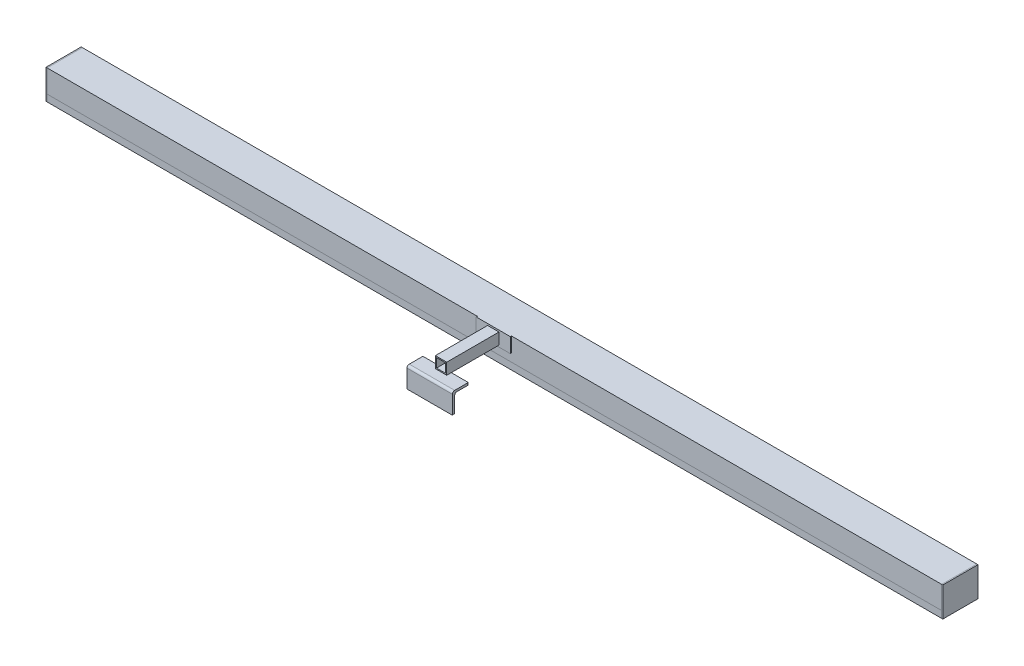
SolidWorks part; units mm, degrees
ref_plane "Alzado" through (0, 0, 0) normal (0, 0, 1) x (1, 0, 0)
ref_plane "Planta" through (0, 0, 0) normal (0, 1, 0) x (1, 0, 0)
ref_plane "Vista lateral" through (0, 0, 0) normal (1, 0, 0) x (0, 0, -1)
sketch "Croquis1" plane through (0, 0, 0) normal (0, 0, 1) x (1, 0, 0)
  line L0 (0, -9) -> (0, 9) construction
  line L1 (-20, 0) -> (20, 0) construction
  line L3 (-20, -9) -> (20, -9)
  line L4 (-20, -9) -> (-20, 9)
  line L5 (-20, 9) -> (20, 9)
  line L6 (20, -9) -> (20, 9)
  point P4 (0, 0)
  point P8 (0, 0)
  point P12 (0, 0)
  point P13 (0, 0)
  dimension "D1" = 18
  dimension "D2" = 40
extrude "Saliente-Extruir1" add sketch "Croquis1" along normal blind 2
sketch "Croquis2" plane through (0, 9, 0) normal (0, 1, 0) x (1, 0, 0)
  line L0 (0, -2) -> (0, 12) construction
  line L1 (20, -2) -> (-20, -2) construction
  line L2 (0, 12) -> (-20, 12)
  line L3 (-20, 12) -> (-20, -2)
  line L4 (-20, -2) -> (20, -2)
  line L5 (20, -2) -> (20, 12)
  line L6 (20, 12) -> (0, 12)
  dimension "D1" = 14
extrude "Saliente-Extruir2" add sketch "Croquis2" against normal blind 2
fillet "Redondeo1" radius 2 1 edges at (0, 7, 0)
fillet "Redondeo2" radius 2 1 edges at (0, 9, 2)
fillet "Redondeo3" radius 0.5 1 edges at (20, -9, 1)
fillet "Redondeo4" radius 0.5 1 edges at (-20, -9, 1)
fillet "Redondeo5" radius 0.5 1 edges at (-20, 8, -12)
fillet "Redondeo6" radius 0.5 1 edges at (20, 8, -12)
ref_plane "Plano1" through (0, 0, -8) normal (0, 0, 1) x (1, 0, 0)
sketch "Croquis5" plane through (0, 0, -8) normal (0, 0, 1) x (1, 0, 0)
  line L0 (0, 9) -> (0, 13.0338) construction
  line L1 (-20, 9) -> (20, 9) construction
  line L2 (-5, 9) -> (5, 9)
  line L3 (-4, 10) -> (-4, 18)
  line L4 (-5, 9) -> (5, 9)
  line L5 (-5, 9) -> (-5, 19)
  line L6 (-5, 19) -> (5, 19)
  line L7 (5, 9) -> (5, 19)
  line L8 (-4, 18) -> (4, 18)
  line L9 (4, 10) -> (4, 18)
  line L10 (-4, 10) -> (4, 10)
  point P8 (0, 9)
  dimension "D1" = 1
extrude "Saliente-Extruir3" add sketch "Croquis5" against normal blind 46
sketch "Croquis6" plane through (0, 0, -54) normal (0, 0, -1) x (-1, 0, 0)
  line L0 (0, 19) -> (0, 9) construction
  line L1 (5, 19) -> (-5, 19) construction
  line L2 (5, 9) -> (-5, 9) construction
  line L3 (-15, 14) -> (15, 14) construction
  line L4 (0, 7.5) -> (0, 20.5) construction
  line L6 (-15, 7.5) -> (15, 7.5)
  line L7 (-15, 7.5) -> (-15, 20.5)
  line L8 (-15, 20.5) -> (15, 20.5)
  line L9 (15, 7.5) -> (15, 20.5)
  point P9 (0, 14)
  point P13 (0, 14)
  point P17 (0, 0)
  point P18 (0, 0)
  dimension "D1" = 13
  dimension "D2" = 30
extrude "Saliente-Extruir4" add sketch "Croquis6" along normal blind 1
sketch "Croquis7" plane through (0, 0, -55) normal (0, 0, -1) x (-1, 0, 0)
  line L0 (-394, 20.5) -> (394, 20.5)
  line L1 (0, 0) -> (0, 20.5) construction
  line L2 (394, 20.5) -> (394, 0.5)
  line L3 (394, 0.5) -> (-394, 0.5)
  line L4 (-394, 0.5) -> (-394, 20.5)
  point P3 (0, 20.5)
  dimension "D1" = 788
  dimension "D2" = 20
extrude "Saliente-Extruir5" add sketch "Croquis7" along normal blind 31
sketch "Croquis9" plane through (0, 0.5, 0) normal (0, -1, 0) x (1, 0, 0)
  line L1 (-394, -55) -> (394, -55)
  line L2 (-394, -55) -> (-394, -86)
  line L3 (-394, -86) -> (394, -86)
  line L4 (394, -55) -> (394, -86)
extrude "Saliente-Extruir7" add sketch "Croquis9" along normal blind 6 separate body
sketch "Croquis10" plane through (-394, 0, 0) normal (-1, 0, 0) x (0, 0, 1)
  line L1 (-86, 20.5) -> (-55, 20.5)
  line L2 (-86, 20.5) -> (-86, -5.5)
  line L3 (-86, -5.5) -> (-55, -5.5)
  line L4 (-55, 20.5) -> (-55, -5.5)
extrude "Saliente-Extruir8" add sketch "Croquis10" along normal blind 1 separate body
sketch "Croquis11" plane through (394, 0, 0) normal (1, 0, 0) x (0, 0, -1)
  line L1 (55, 20.5) -> (86, 20.5)
  line L2 (55, 20.5) -> (55, -5.5)
  line L3 (55, -5.5) -> (86, -5.5)
  line L4 (86, 20.5) -> (86, -5.5)
extrude "Saliente-Extruir9" add sketch "Croquis11" along normal blind 1 separate body
sketch "Croquis12" plane through (395, 0, 0) normal (1, 0, 0) x (0, 0, -1)
  line L1 (55, -5.5) -> (55, 20.5)
  line L3 (55, 20.5) -> (86, 20.5)
  line L4 (86, 20.5) -> (86, -5.5)
  line L5 (70.5, 20.5) -> (70.5, -5.5) construction
  line L6 (55, -5.5) -> (86, -5.5) construction
  line L7 (55, 7.5) -> (86, 7.5) construction
  line L8 (86, -5.5) -> (86, 20.5) construction
  line L9 (86, -5.5) -> (55, -5.5)
  arc A0 (84.607, -4.9143) -> (85.4555, -4.0729) centre (84.4666, -3.9242) ccw
  arc A1 (85.4555, 19.0729) -> (84.607, 19.9143) centre (84.4666, 18.9242) ccw
  arc A2 (56.393, 19.9143) -> (55.5445, 19.0729) centre (56.5334, 18.9242) ccw
  arc A3 (55.5445, -4.0729) -> (56.393, -4.9143) centre (56.5334, -3.9242) ccw
  ellipse E0 centre (70.5, -4.5) end of major axis (86, -4.5) minor radius 1 (56.393, -4.9143) -> (84.607, -4.9143) ccw
  ellipse E1 centre (56, 7.5) end of major axis (56, -5.5) minor radius 1 (55.5445, 19.0729) -> (55.5445, -4.0729) ccw
  ellipse E3 centre (85, 7.5) end of major axis (85, 20.5) minor radius 1 (85.4555, -4.0729) -> (85.4555, 19.0729) ccw
  ellipse E6 centre (70.5, 19.5) end of major axis (55, 19.5) minor radius 1 (84.607, 19.9143) -> (56.393, 19.9143) ccw
  point P5 (70.5, 20.5)
  point P8 (55, 7.5)
  point P42 (0, 0)
  dimension "D1" = 1
  dimension "D2" = 1
